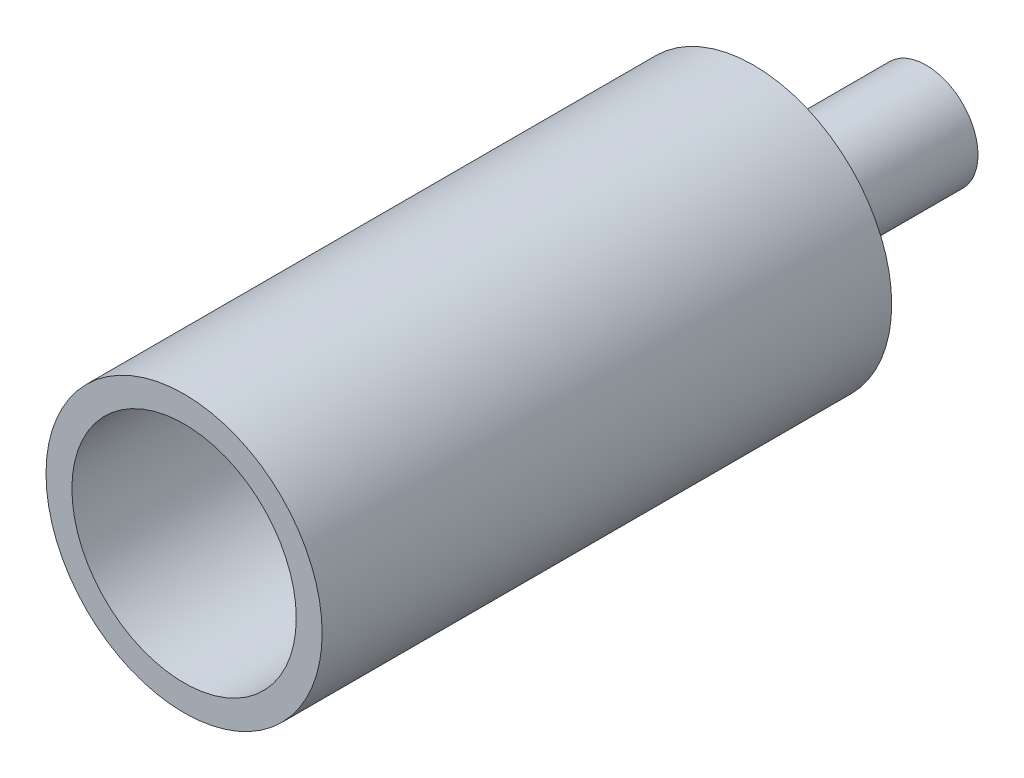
SolidWorks part; units mm, degrees
ref_plane "Plan de face" through (0, 0, 0) normal (0, 0, 1) x (1, 0, 0)
ref_plane "Plan de dessus" through (0, 0, 0) normal (0, 1, 0) x (1, 0, 0)
ref_plane "Plan de droite" through (0, 0, 0) normal (1, 0, 0) x (0, 0, -1)
sketch "Esquisse1" plane through (0, 0, 0) normal (0, 0, 1) x (1, 0, 0)
  circle A0 centre (-13, 3.9282) radius 1.5 construction
  circle A1 centre (-13, 3.9282) radius 1.5
  circle A2 centre (-13, 3.9282) radius 0.75
  dimension "D1" = 1.5
extrude "Extrusion1" add sketch "Esquisse1" against normal blind 5
sketch "Esquisse2" plane through (0, 0, 0) normal (0, 0, 1) x (1, 0, 0)
  circle A0 centre (-13, 3.9282) radius 4
  circle A1 centre (-13, 3.9282) radius 1.5 construction
  circle A2 centre (-13, 3.9282) radius 0.75 construction
  circle A3 centre (-13, 3.9282) radius 0.75
  dimension "D1" = 8
extrude "Extrusion2" add sketch "Esquisse2" along normal blind 1
sketch "Esquisse3" plane through (0, 0, 1) normal (0, 0, 1) x (1, 0, 0)
  circle A0 centre (-13, 3.9282) radius 4 construction
  circle A1 centre (-13, 3.9282) radius 4
  circle A2 centre (-13, 3.9282) radius 3.25
  dimension "D1" = 6.5
extrude "Extrusion3" add sketch "Esquisse3" along normal blind 15.5
